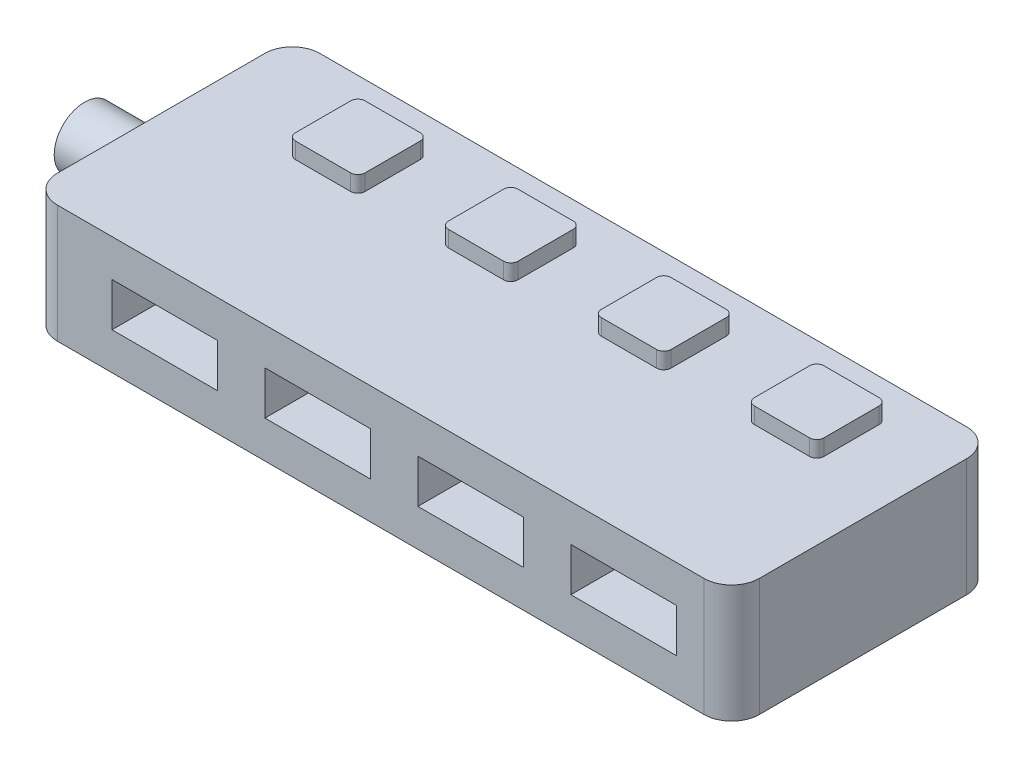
SolidWorks part; units mm, degrees
ref_plane "Front Plane" through (0, 0, 0) normal (0, 0, 1) x (1, 0, 0)
ref_plane "Top Plane" through (0, 0, 0) normal (0, 1, 0) x (1, 0, 0)
ref_plane "Right Plane" through (0, 0, 0) normal (1, 0, 0) x (0, 0, -1)
sketch "Sketch1" plane through (0, 0, 0) normal (0, 1, 0) x (1, 0, 0)
  line L0 (0, 0) -> (0, 24.7904)
  line L1 (3.302, 28.0924) -> (80.6196, 28.0924)
  line L2 (83.9216, 24.7904) -> (83.9216, 0)
  line L3 (80.6196, -3.302) -> (3.302, -3.302)
  arc A0 (0, 24.7904) -> (3.302, 28.0924) centre (3.302, 24.7904) cw
  arc A1 (80.6196, 28.0924) -> (83.9216, 24.7904) centre (80.6196, 24.7904) cw
  arc A2 (83.9216, 0) -> (80.6196, -3.302) centre (80.6196, 0) cw
  arc A3 (3.302, -3.302) -> (0, 0) centre (3.302, 0) cw
  point P13 (0, 19.9082)
  dimension "D3" = 3.302
  dimension "D1" = 31.3944
  dimension "D2" = 83.9216
extrude "Boss-Extrude1" add sketch "Sketch1" along normal blind 14.097
sketch "Sketch2" plane through (0, 14.097, 0) normal (0, 1, 0) x (1, 0, 0)
  line L0 (11.9761, 16.4936) -> (11.9761, 23.0923)
  line L1 (12.836, 23.9522) -> (19.4347, 23.9522)
  line L2 (20.2946, 23.0923) -> (20.2946, 16.4936)
  line L3 (19.4347, 15.6337) -> (12.836, 15.6337)
  line L4 (0, 24.7904) -> (0, 0) construction
  line L5 (80.6196, 28.0924) -> (3.302, 28.0924) construction
  line L6 (30.2641, 16.4936) -> (30.2641, 23.0923)
  line L7 (31.124, 23.9522) -> (37.7227, 23.9522)
  line L8 (38.5826, 23.0923) -> (38.5826, 16.4936)
  line L9 (37.7227, 15.6337) -> (31.124, 15.6337)
  line L10 (48.5521, 16.4936) -> (48.5521, 23.0923)
  line L11 (49.412, 23.9522) -> (56.0107, 23.9522)
  line L12 (56.8706, 23.0923) -> (56.8706, 16.4936)
  line L13 (56.0107, 15.6337) -> (49.412, 15.6337)
  line L14 (66.8401, 16.4936) -> (66.8401, 23.0923)
  line L15 (67.7, 23.9522) -> (74.2987, 23.9522)
  line L16 (75.1586, 23.0923) -> (75.1586, 16.4936)
  line L17 (74.2987, 15.6337) -> (67.7, 15.6337)
  arc A0 (11.9761, 23.0923) -> (12.836, 23.9522) centre (12.836, 23.0923) cw
  arc A1 (19.4347, 23.9522) -> (20.2946, 23.0923) centre (19.4347, 23.0923) cw
  arc A2 (20.2946, 16.4936) -> (19.4347, 15.6337) centre (19.4347, 16.4936) cw
  arc A3 (12.836, 15.6337) -> (11.9761, 16.4936) centre (12.836, 16.4936) cw
  arc A4 (30.2641, 23.0923) -> (31.124, 23.9522) centre (31.124, 23.0923) cw
  arc A5 (37.7227, 23.9522) -> (38.5826, 23.0923) centre (37.7227, 23.0923) cw
  arc A6 (38.5826, 16.4936) -> (37.7227, 15.6337) centre (37.7227, 16.4936) cw
  arc A7 (31.124, 15.6337) -> (30.2641, 16.4936) centre (31.124, 16.4936) cw
  arc A8 (48.5521, 23.0923) -> (49.412, 23.9522) centre (49.412, 23.0923) cw
  arc A9 (56.0107, 23.9522) -> (56.8706, 23.0923) centre (56.0107, 23.0923) cw
  arc A10 (56.8706, 16.4936) -> (56.0107, 15.6337) centre (56.0107, 16.4936) cw
  arc A11 (49.412, 15.6337) -> (48.5521, 16.4936) centre (49.412, 16.4936) cw
  arc A12 (66.8401, 23.0923) -> (67.7, 23.9522) centre (67.7, 23.0923) cw
  arc A13 (74.2987, 23.9522) -> (75.1586, 23.0923) centre (74.2987, 23.0923) cw
  arc A14 (75.1586, 16.4936) -> (74.2987, 15.6337) centre (74.2987, 16.4936) cw
  arc A15 (67.7, 15.6337) -> (66.8401, 16.4936) centre (67.7, 16.4936) cw
  dimension "D1" = 8.3185
  dimension "D2" = 11.9761
  dimension "D3" = 4.1402
  dimension "D4" = 4
extrude "Boss-Extrude2" add sketch "Sketch2" along normal blind 1.9304
sketch "Sketch4" plane through (0, 0, 3.302) normal (0, 0, 1) x (1, 0, 0)
  line L0 (22.4409, 9.652) -> (28.1178, 9.652) construction
  line L1 (9.8298, 4.445) -> (22.4409, 4.445)
  line L2 (9.8298, 4.445) -> (9.8298, 9.652)
  line L3 (9.8298, 9.652) -> (22.4409, 9.652)
  line L4 (22.4409, 4.445) -> (22.4409, 9.652)
  line L5 (28.1178, 4.445) -> (40.7289, 4.445)
  line L6 (28.1178, 4.445) -> (28.1178, 9.652)
  line L7 (28.1178, 9.652) -> (40.7289, 9.652)
  line L8 (40.7289, 4.445) -> (40.7289, 9.652)
  line L9 (46.4058, 4.445) -> (59.0169, 4.445)
  line L10 (46.4058, 4.445) -> (46.4058, 9.652)
  line L11 (46.4058, 9.652) -> (59.0169, 9.652)
  line L12 (59.0169, 4.445) -> (59.0169, 9.652)
  line L13 (64.6938, 4.445) -> (77.3049, 4.445)
  line L14 (64.6938, 4.445) -> (64.6938, 9.652)
  line L15 (64.6938, 9.652) -> (77.3049, 9.652)
  line L16 (77.3049, 4.445) -> (77.3049, 9.652)
  line L17 (40.7289, 9.652) -> (46.4058, 9.652) construction
  line L18 (59.0169, 9.652) -> (64.6938, 9.652) construction
  line L19 (64.6938, 9.652) -> (64.755, 9.6975) construction
  line L20 (12.836, 16.0274) -> (19.4347, 16.0274) construction
  line L21 (12.836, 16.0274) -> (19.4347, 16.0274) construction
  line L22 (67.7, 16.0274) -> (74.2987, 16.0274) construction
  line L23 (67.7, 16.0274) -> (74.2987, 16.0274) construction
  line L24 (3.302, 14.097) -> (3.302, 0) construction
  point P19 (16.1353, 16.0274)
  point P20 (16.1353, 9.652)
  point P23 (70.9993, 16.0274)
  point P24 (70.9993, 9.652)
  point P27 (3.302, 7.0485)
  point P28 (9.8298, 7.0485)
  dimension "D1" = 12.6111
  dimension "D2" = 5.207
extrude "Cut-Extrude1" cut sketch "Sketch4" against normal blind 9.144
sketch "Sketch5" plane through (0, 0, 0) normal (-1, 0, 0) x (0, 0, 1)
  line L0 (0, 14.097) -> (0, 0) construction
  line L1 (-24.7904, 0) -> (0, 0) construction
  circle A0 centre (-12.3952, 7.0485) radius 3.6322
  point P2 (0, 0)
  point P5 (0, 7.0485)
  point P6 (0, 0)
  point P9 (-12.3952, 0)
  dimension "D1" = 7.2644
extrude "Boss-Extrude3" add sketch "Sketch5" along normal blind 9.144
